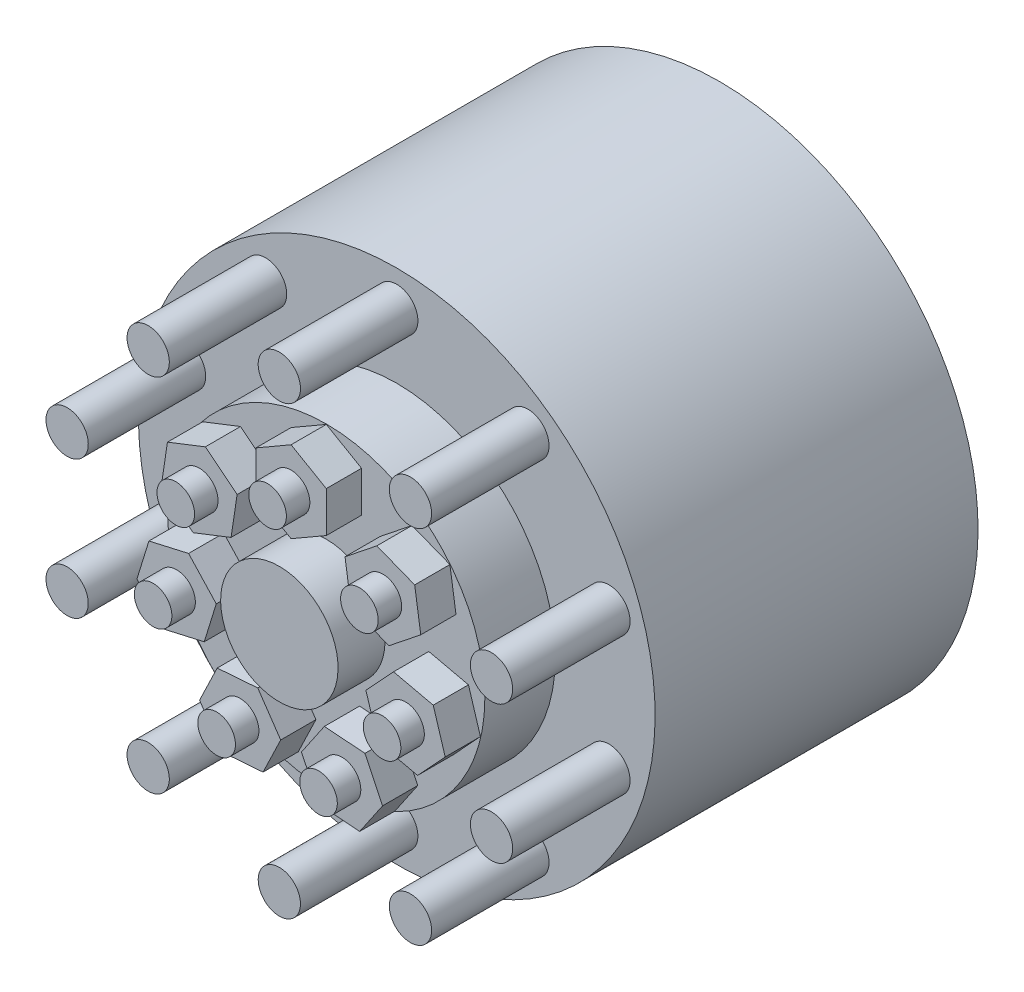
SolidWorks part; units mm, degrees
ref_plane "Front Plane" through (0, 0, 0) normal (0, 0, 1) x (1, 0, 0)
ref_plane "Top Plane" through (0, 0, 0) normal (0, 1, 0) x (1, 0, 0)
ref_plane "Right Plane" through (0, 0, 0) normal (1, 0, 0) x (0, 0, -1)
sketch "Sketch2" plane through (0, 0, 0) normal (1, 0, 0) x (0, 0, -1)
  line L0 (0, 0) -> (-375, 0) construction
  line L1 (-375, 0) -> (-375, 50)
  line L2 (-375, 50) -> (-335, 50)
  line L3 (-335, 50) -> (-335, 135)
  line L4 (-335, 135) -> (-275, 135)
  line L5 (-275, 135) -> (-275, 220)
  line L6 (-275, 220) -> (0, 220)
  line L7 (0, 220) -> (0, 0)
  line L8 (0, 0) -> (-375, 0)
  dimension "D1" = 220
  dimension "D2" = 135
  dimension "D3" = 50
  dimension "D4" = 40
  dimension "D5" = 275
  dimension "D6" = 60
revolve "Revolve1" add sketch "Sketch2" angle 360 about L0
sketch "Sketch3" plane through (0, 0, 275) normal (0, 0, 1) x (1, 0, 0)
  circle A1 centre (0, 190) radius 18
  dimension "D1" = 190
extrude "Boss-Extrude1" add sketch "Sketch3" along normal blind 100
pattern_circular "CirPattern1" count 10 over 360 about axis through (0, 0, 0) along (0, 0, 1) of "Boss-Extrude1"
sketch "Sketch4" plane through (0, 0, 335) normal (0, 0, 1) x (1, 0, 0)
  circle A1 centre (0, 100) radius 16
  dimension "D1" = 100
sketch "Sketch6" plane through (0, 0, 0) normal (0, 0, -1) x (-1, 0, 0)
  circle A0 centre (0, 0) radius 80
extrude "Cut-Extrude1" cut sketch "Sketch6" against normal blind 50
extrude "Boss-Extrude2" add sketch "Sketch4" along normal blind 50
sketch "Sketch9" plane through (0, 0, 335) normal (0, 0, 1) x (1, 0, 0)
  line L1 (30, 117.3205) -> (0, 134.641)
  line L2 (0, 134.641) -> (-30, 117.3205)
  line L3 (-30, 117.3205) -> (-30, 82.6795)
  line L4 (-30, 82.6795) -> (0, 65.359)
  line L5 (0, 65.359) -> (30, 82.6795)
  line L6 (30, 82.6795) -> (30, 117.3205)
  circle A0 centre (0, 100) radius 30 construction
extrude "Boss-Extrude3" add sketch "Sketch9" along normal blind 30
pattern_circular "CirPattern2" count 7 over 360 about axis through (0, 0, 0) along (0, 0, 1) of "Boss-Extrude2", "Boss-Extrude3"
